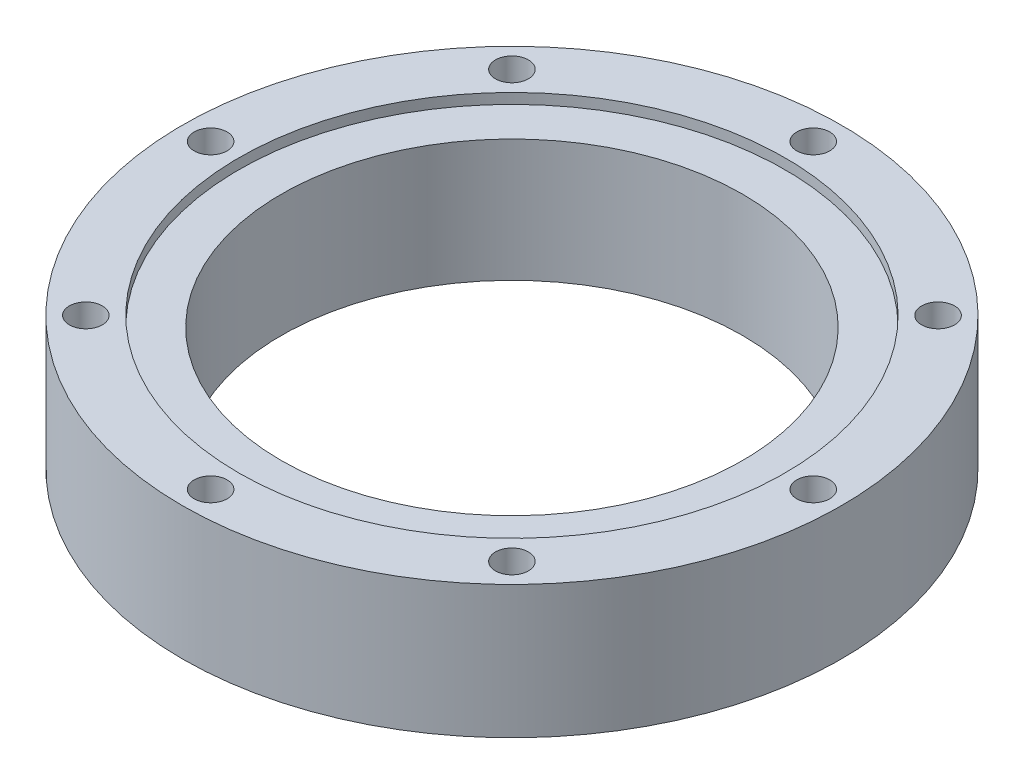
SolidWorks part; units mm, degrees
ref_plane "Alzado" through (0, 0, 0) normal (0, 0, 1) x (1, 0, 0)
ref_plane "Planta" through (0, 0, 0) normal (0, 1, 0) x (1, 0, 0)
ref_plane "Vista lateral" through (0, 0, 0) normal (1, 0, 0) x (0, 0, -1)
sketch "Sketch1" plane through (0, 0, 0) normal (0, 1, 0) x (1, 0, 0)
  circle A0 centre (0, 0) radius 35
  circle A1 centre (0, 0) radius 29
  dimension "D1" = 70
  dimension "D2" = 58
extrude "Boss-Extrude1" add sketch "Sketch1" along normal blind 14.1
sketch "Sketch2" plane through (0, 14.1, 0) normal (0, 1, 0) x (1, 0, 0)
  line L0 (0, 32) -> (0, 0) construction
  circle A0 centre (0, 32) radius 1.75
  circle A1 centre (22.6274, 22.6274) radius 1.75
  circle A2 centre (32, 0) radius 1.75
  circle A3 centre (22.6274, -22.6274) radius 1.75
  circle A4 centre (0, -32) radius 1.75
  circle A5 centre (-22.6274, -22.6274) radius 1.75
  circle A6 centre (-32, 0) radius 1.75
  circle A7 centre (-22.6274, 22.6274) radius 1.75
  dimension "D1" = 32
  dimension "D2" = 3.5
  dimension "D3" = 8
extrude "Cut-Extrude1" cut sketch "Sketch2" against normal through all
sketch "Sketch3" plane through (0, 0, 0) normal (0, 1, 0) x (1, 0, 0)
  circle A0 centre (0, 0) radius 29
  circle A1 centre (0, 0) radius 24.5
  circle A2 centre (0, 0) radius 29 construction
  dimension "D1" = 49
extrude "Boss-Extrude2" add sketch "Sketch3" along normal blind 13
sketch "Sketch4" plane through (0, 0, 0) normal (0, -1, 0) x (-1, 0, 0)
  line L0 (-29.5641, -12.2459) -> (29.5641, 12.2459) construction
  line L1 (0, 0) -> (0, -32) construction
  circle A0 centre (-29.5641, -12.2459) radius 1.5
  circle A1 centre (29.5641, 12.2459) radius 1.5
  point P5 (0, 0)
  dimension "D2" = 3
  dimension "D3" = 32
  dimension "D1" = 67.5
extrude "Cut-Extrude2" cut sketch "Sketch4" against normal blind 5
